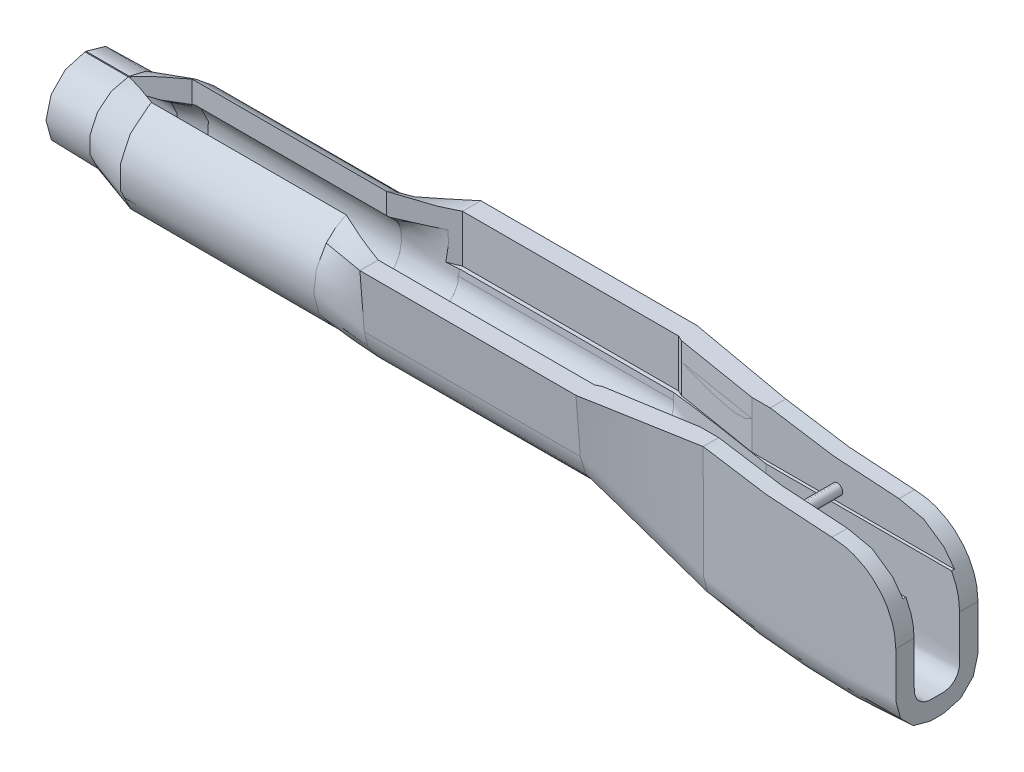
SolidWorks part; units mm, degrees
ref_plane "Front Plane" through (0, 0, 0) normal (0, 0, 1) x (1, 0, 0)
ref_plane "Top Plane" through (0, 0, 0) normal (0, 1, 0) x (1, 0, 0)
ref_plane "Right Plane" through (0, 0, 0) normal (1, 0, 0) x (0, 0, -1)
sketch "Sketch1" plane through (0, 0, 0) normal (1, 0, 0) x (0, 0, -1)
  circle A0 centre (0, 0) radius 4.6482
  dimension "D1" = 9.2964
extrude "Extrude1" add sketch "Sketch1" along normal blind 5.08
sketch "Sketch2" plane through (5.08, 0, 0) normal (1, 0, 0) x (0, 0, -1)
  circle A1 centre (0, 0) radius 4.6482
  circle A2 centre (0, 0) radius 4.6482
  dimension "D1" = 0
extrude "Extrude2" add sketch "Sketch2" along normal blind 5.08 draft 17
sketch "Sketch3" plane through (10.16, 0, 0) normal (1, 0, 0) x (0, 0, -1)
  circle A1 centre (0, 0) radius 6.2013
  circle A2 centre (0, 0) radius 6.2013
  dimension "D1" = 0
extrude "Extrude3" add sketch "Sketch3" along normal blind 22.86
ref_plane "Plane1" through (39.37, 0, 0) normal (1, 0, 0) x (0, 0, -1)
sketch "Profile1" plane through (33.02, 0, 0) normal (1, 0, 0) x (0, 0, -1)
  circle A1 centre (0, 0) radius 6.2013
  circle A2 centre (0, 0) radius 6.2013
  dimension "D1" = 0
sketch "Profile2" plane through (39.37, 0, 0) normal (1, 0, 0) x (0, 0, -1)
  line L0 (-1.531, -5.588) -> (1.531, -5.588)
  line L1 (-7.112, 5.588) -> (7.112, 5.588)
  line L2 (-7.112, 5.588) -> (-6.595, -0.9108)
  line L3 (7.112, 5.588) -> (6.595, -0.9108)
  arc A0 (-1.531, -5.588) -> (-6.595, -0.9108) centre (-1.531, -0.508) cw
  arc A1 (6.595, -0.9108) -> (1.531, -5.588) centre (1.531, -0.508) cw
  point P7 (-6.223, -5.588)
  point P10 (6.223, -5.588)
  dimension "D7" = 5.08
  dimension "D1" = 14.224
  dimension "D2" = 12.446
  dimension "D3" = 11.176
  dimension "D4" = 5.588
  dimension "D5" = 6.223
  dimension "D6" = 7.112
loft "Loft1" add profiles "Profile1", "Profile2"
sketch "Sketch9" plane through (39.37, 0, 0) normal (1, 0, 0) x (0, 0, -1)
  line L4 (-7.112, 5.588) -> (-6.595, -0.9108)
  line L5 (-7.112, 5.588) -> (-6.595, -0.9108)
  line L6 (-1.531, -5.588) -> (1.531, -5.588)
  line L7 (7.112, 5.588) -> (-7.112, 5.588)
  line L8 (-1.531, -5.588) -> (1.531, -5.588)
  line L9 (6.595, -0.9108) -> (7.112, 5.588)
  line L10 (6.595, -0.9108) -> (7.112, 5.588)
  line L11 (7.112, 5.588) -> (-7.112, 5.588)
  arc A2 (-6.595, -0.9108) -> (-1.531, -5.588) centre (-1.531, -0.508) ccw
  arc A3 (-6.595, -0.9108) -> (-1.531, -5.588) centre (-1.531, -0.508) ccw
  arc A4 (1.531, -5.588) -> (6.595, -0.9108) centre (1.531, -0.508) ccw
  arc A5 (1.531, -5.588) -> (6.595, -0.9108) centre (1.531, -0.508) ccw
  dimension "D1" = 0
extrude "Extrude5" add sketch "Sketch9" along normal blind 25.4
ref_plane "Plane2" through (77.47, 0, 0) normal (1, 0, 0) x (0, 0, -1)
sketch "Sketch10" plane through (77.47, 0, 0) normal (1, 0, 0) x (0, 0, -1)
  line L0 (-4.8514, 5.588) -> (4.8514, 5.588)
  line L1 (7.112, 5.588) -> (-7.112, 5.588) construction
  line L2 (-0.7583, -11.6332) -> (0.7583, -11.6332)
  line L3 (-4.8514, 5.588) -> (-4.8223, -7.5782)
  line L4 (4.8514, 5.588) -> (4.8223, -7.5782)
  arc A0 (-0.7583, -11.6332) -> (-4.8223, -7.5782) centre (-0.7583, -7.5692) cw
  arc A1 (4.8223, -7.5782) -> (0.7583, -11.6332) centre (0.7583, -7.5692) cw
  point P9 (-4.8133, -11.6332)
  point P12 (4.8133, -11.6332)
  dimension "D6" = 4.064
  dimension "D1" = 9.7028
  dimension "D2" = 4.8514
  dimension "D3" = 4.8133
  dimension "D4" = 9.6266
  dimension "D5" = 17.2212
sketch "Sketch11" plane through (64.77, 0, 0) normal (1, 0, 0) x (0, 0, -1)
  line L4 (7.112, 5.588) -> (-7.112, 5.588)
  line L5 (-7.112, 5.588) -> (-6.595, -0.9108)
  line L6 (-1.531, -5.588) -> (1.531, -5.588)
  line L7 (6.595, -0.9108) -> (7.112, 5.588)
  line L8 (7.112, 5.588) -> (-7.112, 5.588)
  line L9 (-7.112, 5.588) -> (-6.595, -0.9108)
  line L10 (-1.531, -5.588) -> (1.531, -5.588)
  line L11 (6.595, -0.9108) -> (7.112, 5.588)
  arc A2 (-6.595, -0.9108) -> (-1.531, -5.588) centre (-1.531, -0.508) ccw
  arc A3 (1.531, -5.588) -> (6.595, -0.9108) centre (1.531, -0.508) ccw
  arc A4 (-6.595, -0.9108) -> (-1.531, -5.588) centre (-1.531, -0.508) ccw
  arc A5 (1.531, -5.588) -> (6.595, -0.9108) centre (1.531, -0.508) ccw
  dimension "D1" = 0
loft "Loft2" add profiles "Sketch11", "Sketch10"
sketch "Sketch12" plane through (77.47, 0, 0) normal (1, 0, 0) x (0, 0, -1)
  line L4 (-4.8514, 5.588) -> (-4.8223, -7.5782)
  line L5 (-0.7583, -11.6332) -> (0.7583, -11.6332)
  line L6 (4.8223, -7.5782) -> (4.8514, 5.588)
  line L7 (4.8514, 5.588) -> (-4.8514, 5.588)
  line L8 (-4.8514, 5.588) -> (-4.8223, -7.5782)
  line L9 (-0.7583, -11.6332) -> (0.7583, -11.6332)
  line L10 (4.8223, -7.5782) -> (4.8514, 5.588)
  line L11 (4.8514, 5.588) -> (-4.8514, 5.588)
  arc A2 (-4.8223, -7.5782) -> (-0.7583, -11.6332) centre (-0.7583, -7.5692) ccw
  arc A3 (0.7583, -11.6332) -> (4.8223, -7.5782) centre (0.7583, -7.5692) ccw
  arc A4 (-4.8223, -7.5782) -> (-0.7583, -11.6332) centre (-0.7583, -7.5692) ccw
  arc A5 (0.7583, -11.6332) -> (4.8223, -7.5782) centre (0.7583, -7.5692) ccw
  dimension "D1" = 0
sketch "Sketch17" plane through (0, 0, 0) normal (0, 0, 1) x (1, 0, 0)
  line L0 (77.47, 5.588) -> (77.47, -7.5782) construction
  arc A0 (77.47, 0) -> (100.0942, -1.4604) centre (94.0962, 81.5967) ccw
  point P5 (77.47, 0)
sweep "Sweep1" add profiles "Sketch12" path "Sketch17"
shell "Shell8" thickness 2.159
sketch "Sketch18" plane through (2.159, 0, 0) normal (1, 0, 0) x (0, 0, -1)
  circle A1 centre (0, 0) radius 2.4892
  circle A2 centre (0, 0) radius 2.4892
  dimension "D1" = 0
extrude "Cut-Extrude8" cut sketch "Sketch18" against normal up to next
sketch "Sketch15" plane through (0, 0, 0) normal (0, 1, 0) x (1, 0, 0)
  line L0 (0, 0) -> (105.2855, 0) construction
  line L1 (0, 4.6482) -> (0, -4.6482) construction
  line L2 (5.08, 0) -> (10.16, 2.3813)
  line L3 (10.16, 2.3813) -> (33.02, 2.3813)
  line L4 (33.02, 4.7213) -> (33.02, -4.7213) construction
  line L5 (33.02, 2.3813) -> (39.37, 4.9615)
  line L7 (10.16, 6.2013) -> (10.16, -6.2013) construction
  line L8 (39.37, 7.112) -> (39.37, -7.112) construction
  line L9 (75.311, 3.026) -> (101.3308, 3.026)
  line L10 (75.311, -3.026) -> (101.3308, -3.026)
  line L11 (101.3308, 3.026) -> (101.3308, -3.026)
  line L12 (5.08, 4.6482) -> (5.08, -4.6482) construction
  line L13 (65.4216, 4.6532) -> (75.311, 3.026)
  line L14 (65.4216, -4.6532) -> (75.311, -3.026)
  line L15 (39.37, 4.9615) -> (64.77, 4.9615)
  line L16 (10.16, -2.3813) -> (33.02, -2.3813)
  line L17 (5.08, 0) -> (10.16, -2.3813)
  line L18 (33.02, -2.3813) -> (39.37, -4.9615)
  line L19 (64.77, 1.531) -> (64.77, 6.595) construction
  line L20 (64.77, 4.9615) -> (65.4216, 4.6532)
  line L21 (39.37, -4.9615) -> (64.77, -4.9615)
  line L22 (64.77, -4.9615) -> (65.4216, -4.6532)
  spline S1 degree 3 poles (77.2733, 2.6886) (75.1656, 3.0511) (73.0574, 3.4109) (68.8384, 4.1144) (66.7281, 4.4617) (64.6124, 4.7744) knots 0 0 0 0 0.5 0.5 1 1 1 1 construction
  point P22 (101.3308, 0)
  dimension "D1" = 2.3813
extrude "Cut-Extrude3" cut sketch "Sketch15" along normal through all
fillet "Fillet4" radius 7.62 2 edges at (100.0942, 4.1276, -3.9387) (100.0942, 4.1276, 3.9387)
sketch "Sketch19" plane through (0, 0, 0) normal (-1, 0, 0) x (0, 0, 1)
  line L0 (0, 0) -> (0, 8.8579) construction
  line L2 (-0.0635, 4.8422) -> (0.0635, 4.8422)
  line L3 (-0.0635, 4.8422) -> (-0.0635, 2.3426)
  line L4 (-0.0635, 2.3426) -> (0.0635, 2.3426)
  line L5 (0.0635, 4.8422) -> (0.0635, 2.3426)
  dimension "D1" = 0.127
  dimension "D2" = 0.0635
extrude "Cut-Extrude10" cut sketch "Sketch19" against normal through all
sketch "Sketch21" plane through (0, 0, 0) normal (0, 1, 0) x (1, 0, 0)
  line L0 (0, 0.0635) -> (104.462, 0.0635) construction
  line L2 (50.8, 0.6985) -> (43.18, 0.6985)
  line L3 (50.8, 0.6985) -> (50.8, -0.5715)
  line L4 (50.8, -0.5715) -> (43.18, -0.5715)
  line L5 (43.18, 0.6985) -> (43.18, -0.5715)
  dimension "D1" = 50.8
  dimension "D2" = 1.27
  dimension "D3" = 0.635
  dimension "D4" = 7.62
extrude "Cut-Extrude12" cut sketch "Sketch21" against normal through all
sketch "Sketch22" plane through (0, 0, 0) normal (0, 0, 1) x (1, 0, 0)
  line L0 (51.1175, -3.429) -> (51.1175, -2.159)
  line L1 (65.2576, -3.429) -> (39.37, -3.429) construction
  line L2 (50.8, -3.429) -> (50.8, -2.159)
  line L3 (48.8217, -1.2358) -> (49.0508, -1.4556)
  line L4 (50.8, -3.429) -> (51.1175, -3.429)
  arc A0 (50.8, -2.159) -> (49.0508, -1.4556) centre (49.784, -2.159) ccw
  arc A1 (51.1175, -2.159) -> (48.8217, -1.2358) centre (49.784, -2.159) ccw
  dimension "D2" = 1.016
  dimension "D1" = 1.27
  dimension "D3" = 0.3175
extrude "Extrude6" add sketch "Sketch22" along normal up to surface and the other way up to surface
fillet "Fillet12" radius 0.254 1 edges at (51.1175, -3.429, -0.0635)
sketch "Sketch20" plane through (0, 0, 0) normal (0, 0, 1) x (1, 0, 0)
  line L0 (0, 1.27) -> (107.8921, 1.27) construction
  circle A0 centre (85.3745, 1.27) radius 0.635
  dimension "D1" = 1.27
  dimension "D2" = 85.3745
  dimension "D3" = 1.27
extrude "Extrude7" add sketch "Sketch20" along normal up to surface and the other way up to surface
sketch "Sketch23" plane through (0, 0, 0) normal (-1, 0, 0) x (0, 0, 1)
  circle A0 centre (0, 0) radius 3.175
  dimension "D1" = 6.35
extrude "Cut-Extrude13" cut sketch "Sketch23" against normal up to next
chamfer "Chamfer1" distance 0.254 angle 45 1 edges at (0, -3.175, 0)
sketch "Sketch24" plane through (0, 0, 0) normal (0, 0, 1) x (1, 0, 0)
  line L1 (14.0823, 3.8695) -> (29.2708, 3.8695)
  line L2 (11.5423, 1.3295) -> (11.5423, -2.2951)
  line L3 (14.0823, -4.8351) -> (29.2708, -4.8351)
  line L4 (31.8108, 1.3295) -> (31.8108, -2.2951)
  arc A0 (29.2708, -4.8351) -> (31.8108, -2.2951) centre (29.2708, -2.2951) ccw
  arc A1 (31.8108, 1.3295) -> (29.2708, 3.8695) centre (29.2708, 1.3295) ccw
  arc A2 (14.0823, 3.8695) -> (11.5423, 1.3295) centre (14.0823, 1.3295) ccw
  arc A3 (11.5423, -2.2951) -> (14.0823, -4.8351) centre (14.0823, -2.2951) ccw
  dimension "D1" = 2.54
extrude "Extrude8" [suppressed] cut sketch "Sketch24" along normal through all
sketch "Sketch26" plane through (0, -0.527, 6.6256) normal (0, -0.0793, 0.9969) x (1, 0, 0)
  line L4 (39.37, 6.1344) -> (39.37, -0.385)
  line L5 (39.37, -0.385) -> (64.77, -0.385)
  line L6 (64.77, -0.385) -> (64.77, 6.1344)
  line L7 (64.77, 6.1344) -> (39.37, 6.1344)
  line L8 (39.37, 6.1344) -> (39.37, -0.385)
  line L9 (39.37, -0.385) -> (64.77, -0.385)
  line L10 (64.77, -0.385) -> (64.77, 6.1344)
  line L11 (64.77, 6.1344) -> (39.37, 6.1344)
  dimension "D1" = 0
extrude "Extrude9" [suppressed] cut sketch "Sketch26" against normal up to next
ref_plane "Plane3" through (0, 0, -0.0635) normal (0, 0, 1) x (1, 0, 0)
ref_point "Point2"
ref_plane "Plane4" through (50.2815, 0, 0) normal (1, 0, 0) x (0, 0, -1)
